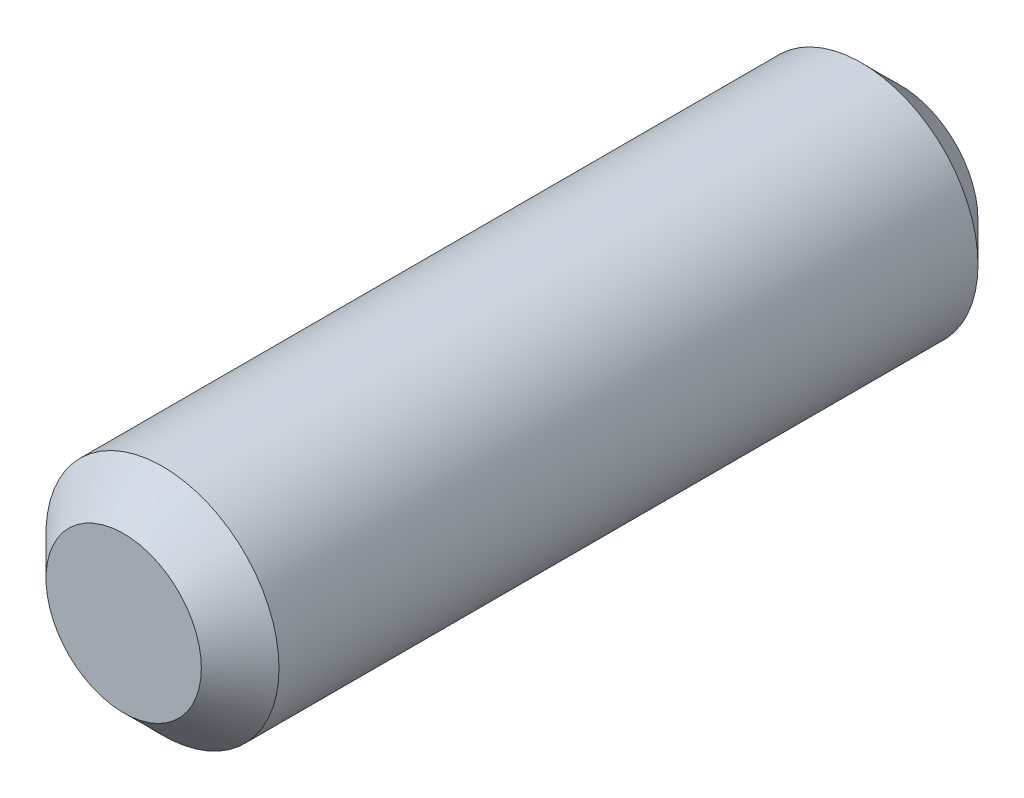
SolidWorks part; units mm, degrees
ref_plane "Face" through (0, 0, 0) normal (0, 0, 1) x (1, 0, 0)
ref_plane "Dessus" through (0, 0, 0) normal (0, 1, 0) x (1, 0, 0)
ref_plane "Droite" through (0, 0, 0) normal (1, 0, 0) x (0, 0, -1)
sketch "Esquisse1" plane through (0, 0, 0) normal (0, 0, 1) x (1, 0, 0)
  circle A0 centre (0, 0) radius 1.5
  dimension "D1" = 3
extrude "Cylindre de base" add sketch "Esquisse1" along normal mid plane 10
chamfer "Chanfrein1" distance 0.5 angle 45
